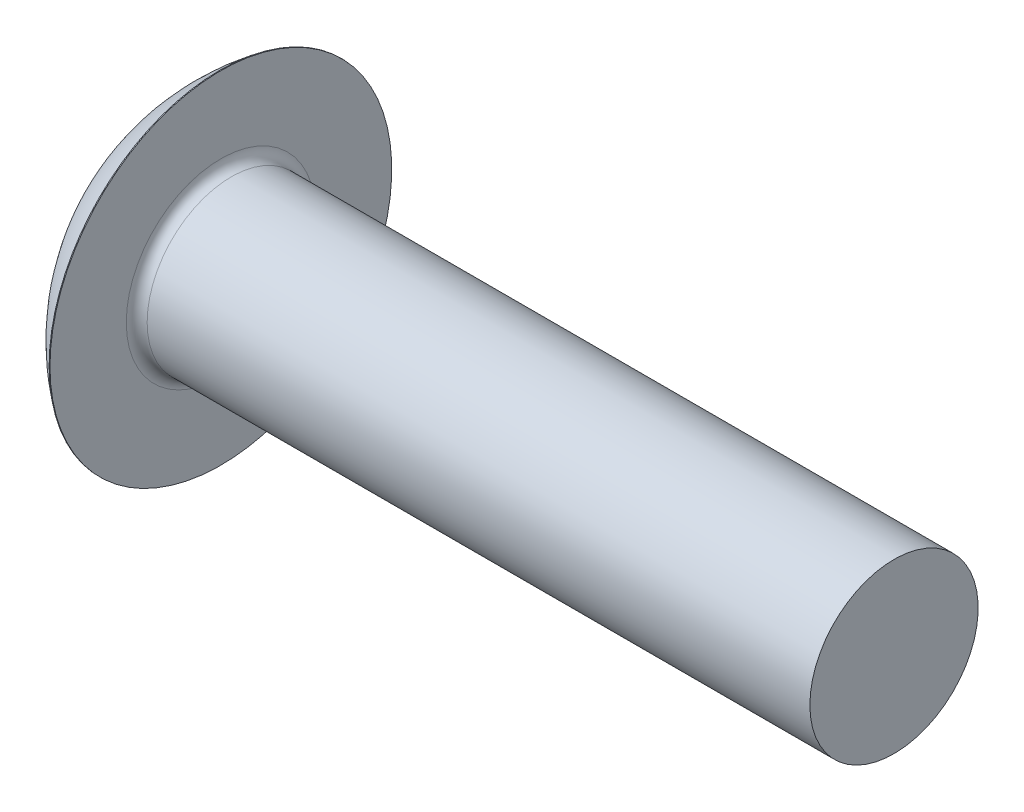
SolidWorks part; units mm, degrees
ref_plane "Plane1" through (0, 0, 0) normal (0, 0, 1) x (1, 0, 0)
ref_plane "Plane2" through (0, 0, 0) normal (0, 1, 0) x (1, 0, 0)
ref_plane "Plane3" through (0, 0, 0) normal (1, 0, 0) x (0, 0, -1)
sketch "BodySke" plane through (0, 0, 0) normal (0, 0, 1) x (1, 0, 0)
  line L0 (0, 0) -> (114.7064, 0)
  line L1 (14.6812, 12.7) -> (114.7064, 12.7)
  line L2 (13.1064, -12.7) -> (114.7064, -12.7) construction
  line L3 (114.7064, 12.7) -> (114.7064, 0)
  line L4 (13.1064, -25.7937) -> (12.9794, -25.7937) construction
  line L5 (13.1064, 25.7937) -> (12.9794, 25.7937)
  line L6 (0, 0) -> (123.825, 0) construction
  line L7 (15.2146, 19.05) -> (15.2146, -3.175) construction
  line L8 (13.1064, 25.7937) -> (13.1064, 14.2748)
  line L9 (85.725, 19.05) -> (85.725, -6.35) construction
  arc A0 (12.9794, 25.7937) -> (0, 0) centre (32.1194, 0) ccw
  arc A1 (14.6812, 12.7) -> (13.1064, 14.2748) centre (14.6812, 14.2748) cw
  point P11 (13.1064, 12.7)
  dimension "D1" = 0.127
  dimension "Fillet_radius" = 1.5748
  dimension "Diameter" = 25.4
  dimension "Length" = 101.6
  dimension "Head_dia" = 51.5874
  dimension "Head_ht" = 13.1064
  dimension "Advance" = 2.1082
  dimension "Thread_nom" = 28.9814
revolve "Base-Revolve" add sketch "BodySke" angle 360 about L6
sketch "ThdSchSke" plane through (0, 0, 0) normal (0, 0, 1) x (1, 0, 0)
  line L0 (85.725, -10.8077) -> (84.4, -12.7)
  line L1 (85.725, -10.8077) -> (87.05, -12.7)
  line L2 (87.05, -12.7) -> (87.05, -15.875)
  line L3 (-3.175, 0) -> (5.1513, 0) construction
  line L5 (87.05, -15.875) -> (84.4, -15.875)
  line L6 (84.4, -15.875) -> (84.4, -12.7)
  point P6 (0, 0)
  dimension "Thread_minor" = 21.6154
  dimension "Diameter" = 25.4
  dimension "Start" = 85.725
  dimension "SideAngle" = 55
  dimension "VeeAngle" = 70
  dimension "Overcut" = 31.75
revolve "ThreadSchematic" [suppressed] cut sketch "ThdSchSke" angle 360 about L3
pattern_linear "ThdSchPat" [suppressed]
equation "\"Thread_length@ThreadCosmetic\" = ((sgn( (\"Length@BodySke\" - \"Advance@BodySke\" ) - \"Thread_nom@BodySke\" )-1)*( (\"Length@BodySke\" - \"Advance@BodySke\" ) - \"Thread_nom@BodySke\" ))/-2+ \"Thread_nom@BodySke\""
equation "\"Thread_minor@ThdSchSke\" = \"Thread_minor@ThreadCosmetic\""
equation "\"Diameter@ThdSchSke\" = \"Diameter@BodySke\""
equation "\"Overcut@ThdSchSke\" = \"Diameter@BodySke\" * 1.25"
equation "\"Start@ThdSchSke\" = \"Head_ht@BodySke\" + \"Length@BodySke\" - \"Thread_length@ThreadCosmetic\"  '---Non-countersunk---"
equation "\"Num_threads@ThdSchPat\" = int( \"Thread_length@ThreadCosmetic\" / \"Advance@BodySke\" + 0.999 )  + 1"
equation "\"Advance@ThdSchPat\" = \"Thread_length@ThreadCosmetic\" /  (\"Num_threads@ThdSchPat\" - 1) 'relax it"
